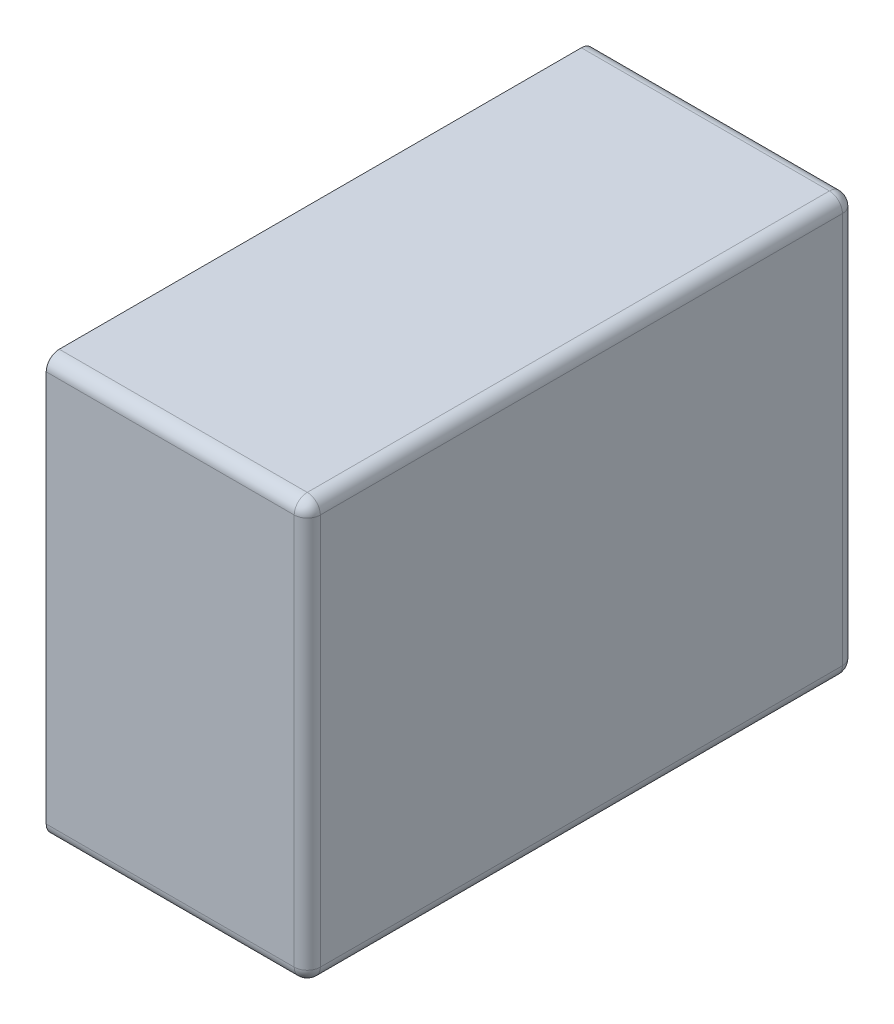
SolidWorks part; units mm, degrees
ref_plane "Front Plane" through (0, 0, 0) normal (0, 0, 1) x (1, 0, 0)
ref_plane "Top Plane" through (0, 0, 0) normal (0, 1, 0) x (1, 0, 0)
ref_plane "Right Plane" through (0, 0, 0) normal (1, 0, 0) x (0, 0, -1)
sketch "Sketch3" plane through (0, 0, 0) normal (1, 0, 0) x (0, 0, -1)
  line L1 (-63, 48) -> (63, 48)
  line L2 (-63, 48) -> (-63, -48)
  line L3 (-63, -48) -> (63, -48)
  line L4 (63, 48) -> (63, -48)
  line L5 (-63, 48) -> (63, -48) construction
  line L6 (-63, -48) -> (63, 48) construction
  point P0 (0, 0)
  dimension "D1" = 126
  dimension "D2" = 96
extrude "Boss-Extrude3" add sketch "Sketch3" along normal blind 60
sketch "Sketch5" plane through (0, 0, 0) normal (-1, 0, 0) x (0, 0, 1)
  line L0 (63, 48) -> (63, -48) construction
  line L1 (-62, 47) -> (62, 47)
  line L2 (-62, 47) -> (-62, -47)
  line L3 (-62, -47) -> (62, -47)
  line L4 (62, 47) -> (62, -47)
  line L5 (-62, 47) -> (62, -47) construction
  line L6 (-62, -47) -> (62, 47) construction
  line L7 (63, -48) -> (-63, -48) construction
  point P0 (0, 0)
  dimension "D1" = 1
  dimension "D2" = 1
extrude "Boss-Extrude4" add sketch "Sketch5" along normal blind 1
sketch "Sketch6" plane through (-1, 0, 0) normal (-1, 0, 0) x (0, 0, 1)
  line L0 (62, -47) -> (62, 47) construction
  line L1 (-61, 46) -> (61, 46)
  line L2 (-61, 46) -> (-61, -46)
  line L3 (-61, -46) -> (61, -46)
  line L4 (61, 46) -> (61, -46)
  line L5 (-61, 46) -> (61, -46) construction
  line L6 (-61, -46) -> (61, 46) construction
  line L7 (-62, -47) -> (62, -47) construction
  point P0 (0, 0)
  dimension "D1" = 1
  dimension "D2" = 1
extrude "Cut-Extrude1" cut sketch "Sketch6" against normal blind 55
fillet "Fillet11" radius 6 1 edges at (26.5, -46, 61)
fillet "Fillet12" radius 6 1 edges at (-0.5, -47, 62)
fillet "Fillet13" radius 6 1 edges at (26.5, 46, 61)
fillet "Fillet14" radius 6 1 edges at (-0.5, 47, 62)
fillet "Fillet15" radius 6 1 edges at (26.5, 46, -61)
fillet "Fillet16" radius 6 1 edges at (-0.5, 47, -62)
fillet "Fillet17" radius 6 1 edges at (26.5, -46, -61)
fillet "Fillet18" radius 6 1 edges at (-0.5, -47, -62)
fillet "Fillet19" radius 3 1 edges at (30, -48, -63)
fillet "Fillet20" radius 3 1 edges at (30, 48, -63)
fillet "Fillet21" radius 3 5 edges at (60, -48, 1.5) (60, -47.1213, -62.1213) (60, 0, -63) (60, 47.1213, -62.1213) (60, 48, 1.5)
fillet "Fillet22" radius 3 5 edges at (28.5, -48, 63) (59.1213, -47.1213, 63) (60, 0, 63) (59.1213, 47.1213, 63) (28.5, 48, 63)
sketch "Sketch8" plane through (0, 0, -61) normal (0, 0, 1) x (1, 0, 0)
  line L0 (54, 40) -> (54, -40) construction
  line L1 (-1, -40) -> (54, -40) construction
  circle A0 centre (20.5, -20) radius 3.5
  dimension "D1" = 33.5
  dimension "D2" = 20
extrude "Cut-Extrude2" cut sketch "Sketch8" against normal through all
sketch "Sketch9" plane through (0, 0, -61) normal (0, 0, 1) x (1, 0, 0)
  line L0 (54, 40) -> (54, -40) construction
  line L1 (54, 40) -> (-1, 40) construction
  circle A0 centre (20.5, 0) radius 6
  dimension "D1" = 33.5
  dimension "D2" = 40
extrude "Cut-Extrude3" cut sketch "Sketch9" against normal through all
sketch "Sketch10" plane through (0, 0, -61) normal (0, 0, 1) x (1, 0, 0)
  line L0 (54, 40) -> (54, -40) construction
  line L1 (54, 40) -> (-1, 40) construction
  circle A0 centre (20.5, 20) radius 6
  dimension "D1" = 33.5
  dimension "D2" = 20
extrude "Cut-Extrude4" cut sketch "Sketch10" against normal through all
